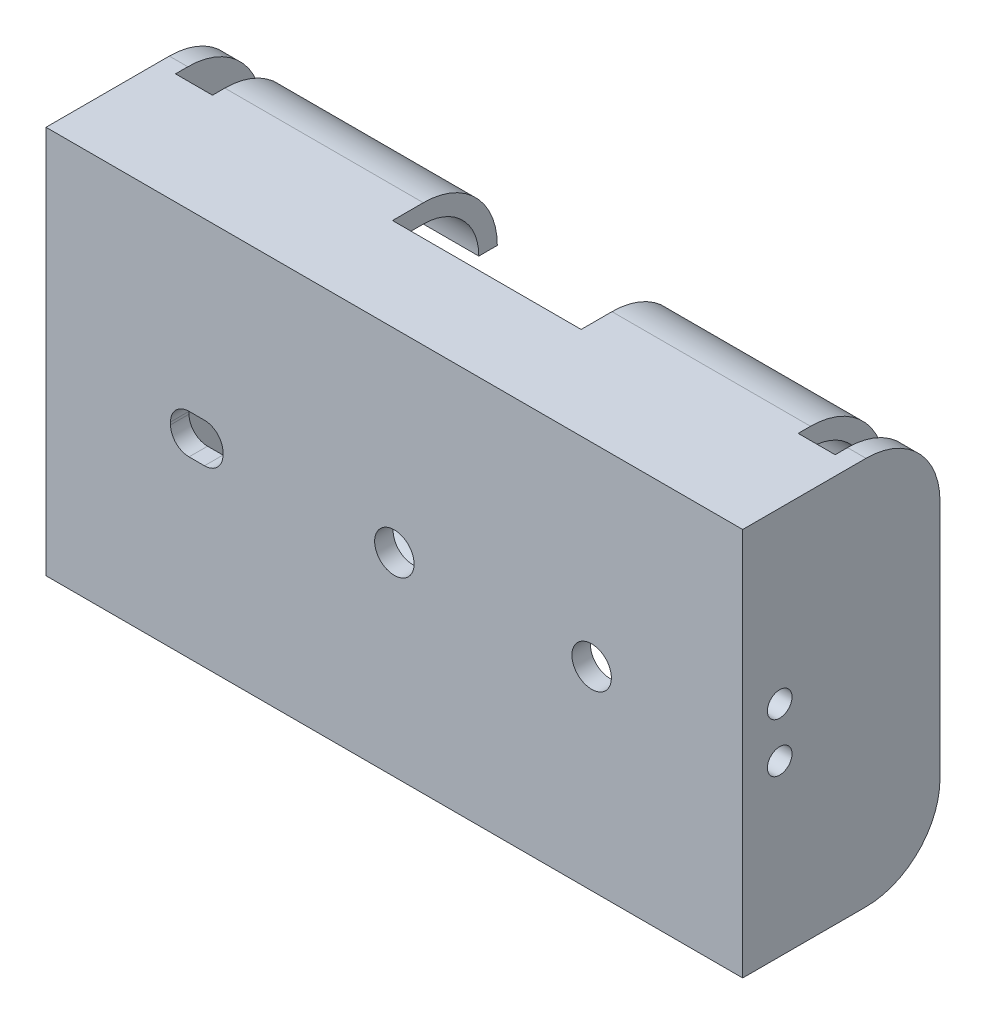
SolidWorks part; units mm, degrees
ref_plane "Face" through (0, 0, 0) normal (0, 0, 1) x (1, 0, 0)
ref_plane "Dessus" through (0, 0, 0) normal (0, 1, 0) x (1, 0, 0)
ref_plane "Droite" through (0, 0, 0) normal (1, 0, 0) x (0, 0, -1)
sketch "Esquisse1" plane through (0, 0, 0) normal (0, 0, 1) x (1, 0, 0)
  line L0 (-28.25, 36.4313) -> (-28.25, -47.0804) construction
  line L1 (28.25, 36.4313) -> (28.25, -47.0804) construction
  line L2 (-42.1762, -15.75) -> (43.8577, -15.75) construction
  line L3 (-42.1762, 15.75) -> (43.8577, 15.75) construction
  line L4 (0, 34.1894) -> (0, -38.1127) construction
  line L5 (-28.25, 15.75) -> (28.25, 15.75)
  line L6 (-28.25, 15.75) -> (-28.25, -15.75)
  line L7 (-28.25, -15.75) -> (28.25, -15.75)
  line L8 (28.25, 15.75) -> (28.25, -15.75)
  line L9 (-16, 30.266) -> (-16, -28.5846) construction
  line L10 (16, 21.5785) -> (16, -21.0181) construction
  line L11 (-44.6984, 0) -> (36.5714, 0) construction
  line L12 (-19.3067, 1.6) -> (-12.9287, 1.6) construction
  line L13 (-18.15, 3.1338) -> (-18.15, -3.1905) construction
  line L14 (-13.9, 3.1338) -> (-13.9, -3.1905) construction
  line L15 (-19.3067, -1.6) -> (-10.7849, -1.6) construction
  line L17 (-16.65, 1.6) -> (-15.4, 1.6)
  line L18 (-18.15, 0.1) -> (-18.15, -0.1)
  line L19 (-16.65, -1.6) -> (-15.4, -1.6)
  line L20 (-13.9, 0.1) -> (-13.9, -0.1)
  circle A0 centre (16, 0) radius 1.6
  arc A1 (-18.15, 0.1) -> (-16.65, 1.6) centre (-16.65, 0.1) cw
  arc A2 (-13.9, 0.1) -> (-15.4, 1.6) centre (-15.4, 0.1) ccw
  arc A3 (-13.9, -0.1) -> (-15.4, -1.6) centre (-15.4, -0.1) cw
  arc A4 (-16.65, -1.6) -> (-18.15, -0.1) centre (-16.65, -0.1) cw
  circle A5 centre (0, 0) radius 1.6
  point P33 (-13.9, 0)
  point P34 (-18.15, 0)
  point P36 (-18.15, 1.6)
  dimension "D1" = 1.5
extrude "Base-Extrusion" add sketch "Esquisse1" against normal blind 16
fillet "Congé1" radius 6
shell "Coque1" thickness 1.5
sketch "Esquisse2" plane through (0, 0, -1.5) normal (0, 0, -1) x (-1, 0, 0)
  line L1 (-22.2587, 5.8559) -> (23.3921, 5.8559)
  line L2 (-22.2587, 5.8559) -> (-22.2587, -6.1707)
  line L3 (-22.2587, -6.1707) -> (23.3921, -6.1707)
  line L4 (23.3921, 5.8559) -> (23.3921, -6.1707)
extrude "Enlèv. mat.-Extru.1" cut sketch "Esquisse2" along normal through all
sketch "Esquisse3" plane through (0, 15.75, 0) normal (0, 1, 0) x (-1, 0, 0)
  line L0 (29.248, -9) -> (-31.6408, -9) construction
  line L1 (26.75, -2.27) -> (26.75, -22.4823) construction
  line L2 (-26.75, -2.27) -> (-26.75, -20.7193) construction
  line L3 (12.4989, -7.5) -> (-13.5693, -7.5) construction
  line L4 (0, -0.5699) -> (0, -21.8527) construction
  line L5 (23.75, -7.5) -> (23.75, -19.2081) construction
  line L6 (7.65, -19.2081) -> (7.65, -4.6628) construction
  line L7 (-7.65, -19.2081) -> (-7.65, -4.159) construction
  line L8 (-26.75, -19.2081) -> (-23.75, -19.2081)
  line L9 (26.75, -9) -> (23.75, -9)
  line L10 (26.75, -9) -> (26.75, -19.2081)
  line L11 (26.75, -19.2081) -> (23.75, -19.2081)
  line L12 (23.75, -9) -> (23.75, -19.2081)
  line L13 (7.65, -7.5) -> (-7.65, -7.5)
  line L14 (7.65, -7.5) -> (7.65, -18.3265)
  line L15 (7.65, -18.3265) -> (-7.65, -18.3265)
  line L16 (-7.65, -7.5) -> (-7.65, -18.3265)
  line L17 (-26.75, -9) -> (-26.75, -19.2081)
  line L18 (-26.75, -9) -> (-23.75, -9)
  line L19 (-23.75, -9) -> (-23.75, -19.2081)
extrude "Enlèv. mat.-Extru.2" cut sketch "Esquisse3" against normal through all
sketch "Esquisse4" plane through (28.25, 0, 0) normal (1, 0, 0) x (0, 0, -1)
  line L0 (-1.5631, 0) -> (18.4717, 0) construction
  line L1 (-1.5631, -2) -> (17.0634, -2) construction
  line L2 (-1.5631, 2) -> (19.7892, 2) construction
  line L3 (3, 3.8616) -> (3, -2.9984) construction
  circle A0 centre (3, 2) radius 1
  circle A1 centre (3, -2) radius 1
extrude "Enlèv. mat.-Extru.3" cut sketch "Esquisse4" against normal blind 6
